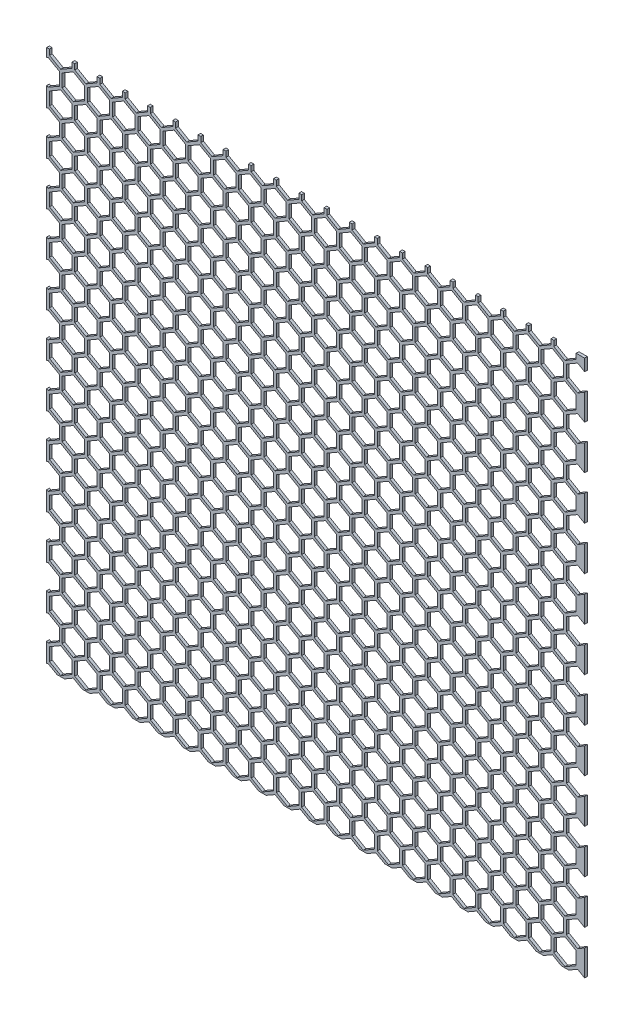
SolidWorks part; units mm, degrees
ref_plane "front" through (0, 0, 0) normal (0, 0, 1) x (1, 0, 0)
ref_plane "top" through (0, 0, 0) normal (0, 1, 0) x (1, 0, 0)
ref_plane "right" through (0, 0, 0) normal (1, 0, 0) x (0, 0, -1)
sheet metal parameters "Sheet-Metal1" thickness 0.762 parameters "D1"=0.762
sketch "Sketch1" plane through (0, 0, 0) normal (0, 0, 1) x (1, 0, 0)
  line L0 (-76.2, 76.2) -> (76.2, -76.2) construction
  line L1 (-76.2, -76.2) -> (76.2, -76.2)
  line L2 (-76.2, -76.2) -> (-76.2, 76.2)
  line L3 (-76.2, 76.2) -> (76.2, 76.2)
  line L4 (76.2, -76.2) -> (76.2, 76.2)
  dimension "D1" = 152.4
  dimension "D2" = 152.4
base flange "Base-Flange1" sketch "Sketch1" thickness 0.762 reverse thickness direction yes parameters "D1"=0.762
sketch "Sketch3" plane through (0, 0, 0.762) normal (0, 0, 1) x (1, 0, 0)
  line L0 (-70.6438, -74.9809) -> (-70.2469, -75.6683) construction
  line L1 (-76.2, 76.2) -> (-76.2, -76.2) construction
  line L2 (-69.0563, -70.3982) -> (-72.2313, -68.5651)
  line L3 (-72.2313, -68.5651) -> (-75.4063, -70.3982)
  line L4 (-75.4063, -70.3982) -> (-75.4063, -74.0643)
  line L6 (-75.4063, -74.0643) -> (-72.2313, -75.8974)
  line L7 (-72.2313, -75.8974) -> (-69.0563, -74.0643)
  line L8 (-69.0563, -74.0643) -> (-69.0563, -70.3982)
  line L9 (-65.4844, -76.5848) -> (-68.6594, -74.7517)
  line L10 (-68.6594, -74.7517) -> (-71.8344, -76.5848)
  line L11 (-71.8344, -76.5848) -> (-71.8344, -80.251)
  line L12 (-71.8344, -80.251) -> (-68.6594, -82.0841)
  line L13 (-68.6594, -82.0841) -> (-65.4844, -80.251)
  line L14 (-65.4844, -80.251) -> (-65.4844, -76.5848)
  line L15 (-68.6594, -74.7517) -> (-68.6594, -102.2717) construction
  line L16 (-68.2625, -101.5437) -> (-68.2625, -103.9907) construction
  line L17 (-76.2, -76.2) -> (76.2, -76.2) construction
  circle A0 centre (-72.2313, -72.2313) radius 3.175 construction
  circle A1 centre (-68.6594, -78.4179) radius 3.175 construction
  dimension "D1" = 6.35
  dimension "D2" = 0.7937
  dimension "D3" = 0.7937
  dimension "D4" = 0.7937
  dimension "D5" = 3.9688
extrude "Cut-Extrude1" cut sketch "Sketch3" against normal up to next
sketch "Sketch4" plane through (0, 0, 0.762) normal (0, 0, 1) x (1, 0, 0)
  line L0 (-73.8188, -74.9809) -> (-74.2156, -75.6683) construction
  line L1 (-75.4063, -74.0643) -> (-72.2313, -75.8974) construction
  line L2 (-70.6438, -74.9809) -> (-70.2469, -75.6683) construction
  line L9 (-72.6281, -76.5848) -> (-75.8031, -74.7517)
  line L10 (-75.8031, -74.7517) -> (-78.9781, -76.5848)
  line L11 (-78.9781, -76.5848) -> (-78.9781, -80.251)
  line L12 (-78.9781, -80.251) -> (-75.8031, -82.0841)
  line L13 (-75.8031, -82.0841) -> (-72.6281, -80.251)
  line L14 (-72.6281, -80.251) -> (-72.6281, -76.5848)
  circle A1 centre (-75.8031, -78.4179) radius 3.175 construction
  dimension "D1" = 6.35
extrude "Extrude1" cut sketch "Sketch4" against normal up to next
pattern_linear "LPattern1" count 21 spacing 7.1437 along (1, 0, 0) count 13 spacing 12.3952 along (0, 1, 0) of "Cut-Extrude1"
pattern_linear "LPattern7" count 13 spacing 12.3952 along (0, 1, 0) of "Extrude1"
flat pattern "Flat-Pattern1"
sketch "Bend-Lines1" plane through (0, 0, 0) normal (0, 1, 0) x (-1, 0, 0)
equation "\"D3@LPattern7\" = \"D4@LPattern1\""
equation "\"D1@LPattern7\" = \"D2@LPattern1\" "
